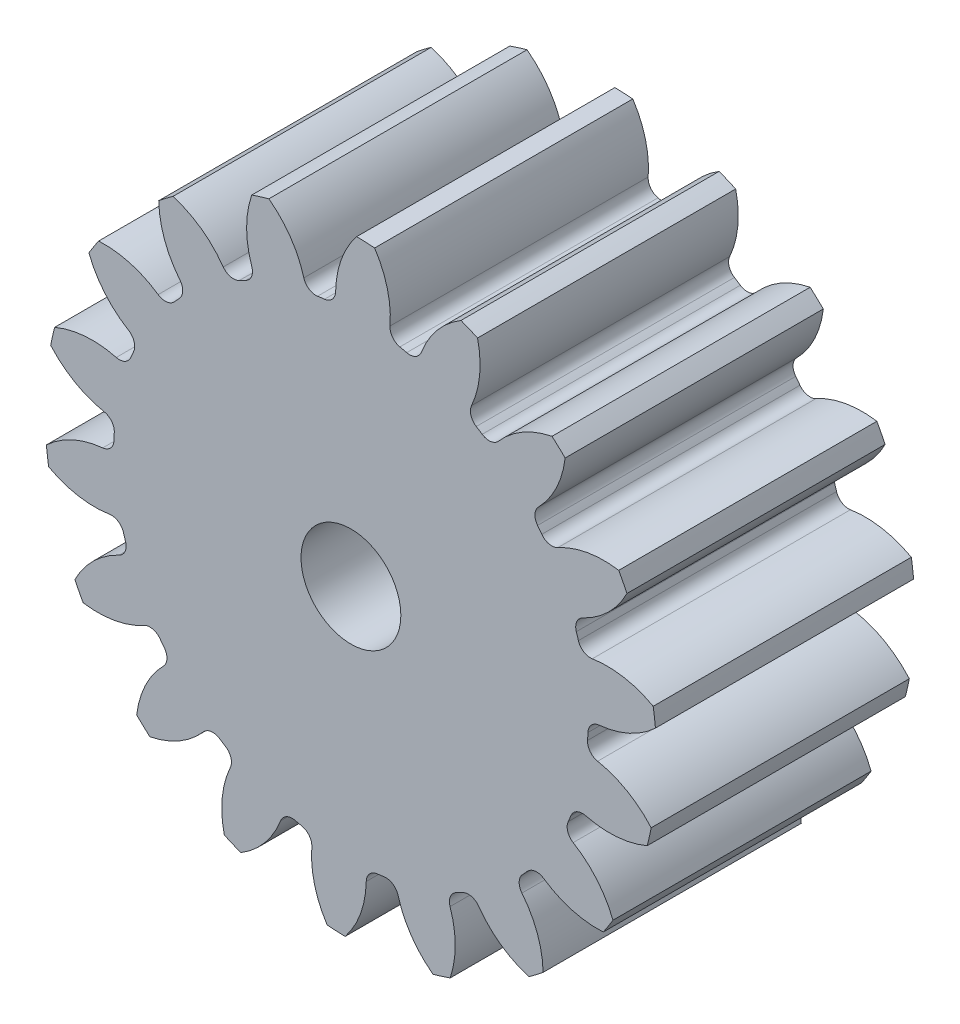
SolidWorks part; units mm, degrees
ref_plane "Front" through (0, 0, 0) normal (0, 0, 1) x (1, 0, 0)
ref_plane "Top" through (0, 0, 0) normal (0, 1, 0) x (1, 0, 0)
ref_plane "Right" through (0, 0, 0) normal (1, 0, 0) x (0, 0, -1)
sketch "Sketch3" plane through (0, 0, 0) normal (0, 0, 1) x (1, 0, 0)
  circle A0 centre (0, 0) radius 112.8889
  dimension "od" = 225.7778
extrude "gearBody" add sketch "Sketch3" along normal blind 95.25
sketch "Sketch2" plane through (0, 0, 0) normal (0, 0, 1) x (1, 0, 0)
  line L0 (0, 0) -> (88.2053, 36.5358) construction
  line L1 (111.2624, -22.2573) -> (0, 0) construction
  line L2 (0, 0) -> (36.3143, 0) construction
  line L3 (101.5232, 3.9498) -> (100.6707, -13.7099) construction
  line L5 (101.097, -4.8801) -> (0, 0) construction
  line L7 (0, 0) -> (95.4728, 0) construction
  arc A0 (95.45, 2.0869) -> (94.8052, -11.2707) centre (0, 0) ccw construction
  arc A1 (112.3588, 10.9268) -> (110.784, -21.6981) centre (0, 0) ccw construction
  arc A2 (101.5232, 3.9498) -> (100.6707, -13.7099) centre (0, 0) ccw construction
  arc A3 (87.3151, -5.5123) -> (87.44, -2.9233) centre (0, 0) ccw
  arc A4 (111.2624, -22.2573) -> (91.0203, -10.3113) centre (84.2762, -44.8617) ccw
  arc A5 (111.2624, -22.2573) -> (112.8889, 11.4373) centre (0, 0) ccw
  arc A6 (112.8889, 11.4373) -> (91.5903, 1.4965) centre (88.2053, 36.5358) cw
  arc A7 (87.44, -2.9233) -> (91.5903, 1.4965) centre (92.032, -3.0768) cw
  arc A8 (91.0203, -10.3113) -> (87.3151, -5.5123) centre (91.9005, -5.8018) cw
  point P6 (112.8889, 11.4373)
  point P22 (111.2624, -22.2573)
  dimension "baseDia" = 190.9455
  dimension "od" = 225.7778
  dimension "pd" = 203.2
  dimension "rd" = 174.9778
  dimension "rFillet" = 4.5946
  dimension "pointX" = 112.8889
  dimension "pointY" = 11.4373
  dimension "CTT" = 17.6597
  dimension "flankCenterAngle" = 22.5
extrude "toothCut" cut sketch "Sketch2" along normal through all
pattern_circular "CirPattern1" count 18 over 360 about axis through (0, 0, 0) along (0, 0, 1) of "toothCut"
sketch "hub1Dia" plane through (0, 0, 0) normal (0, 0, -1) x (-1, 0, 0)
  circle A0 centre (0, 0) radius 12.7
  dimension "hub1Dia" = 25.4
sketch "hub2Dia" plane through (0, 0, 95.25) normal (0, 0, 1) x (1, 0, 0)
  circle A0 centre (0, 0) radius 12.7
  dimension "hub2dia" = 25.4
sketch "boreDia" plane through (0, 0, 0) normal (0, 0, 1) x (1, 0, 0)
  circle A0 centre (0, 0) radius 18.415
  dimension "boreDia" = 36.83
extrude "bore" cut sketch "boreDia" against normal mid plane 25400
